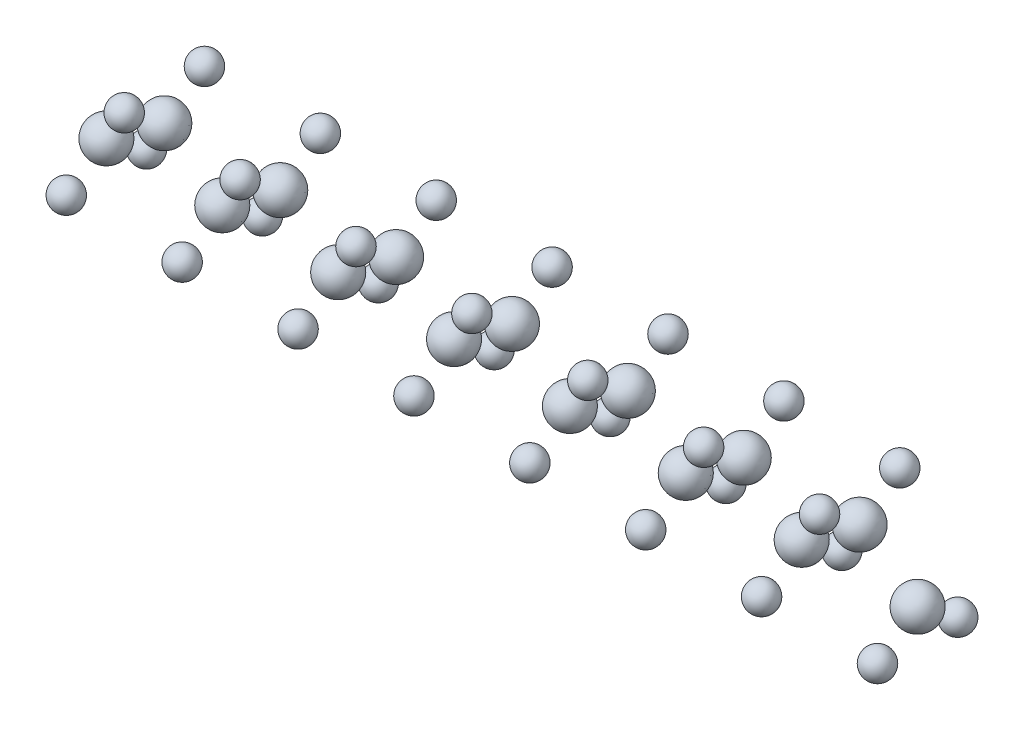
SolidWorks part; units mm, degrees
ref_plane "Front Plane" through (0, 0, 0) normal (0, 0, 1) x (1, 0, 0)
ref_plane "Top Plane" through (0, 0, 0) normal (0, 1, 0) x (1, 0, 0)
ref_plane "Right Plane" through (0, 0, 0) normal (1, 0, 0) x (0, 0, -1)
sketch "Sketch2" plane through (0, 0, 0) normal (0, 0, 1) x (1, 0, 0)
  line L0 (0, 0.425) -> (0, -0.425)
  arc A0 (0, 0.425) -> (0, -0.425) centre (0, 0) cw
  dimension "D2" = 0.85
  dimension "D1" = 0.425
revolve "Revolve2" add sketch "Sketch2" angle 360 about L0
sketch "Sketch3" plane through (0, 0, 0) normal (0, 0, 1) x (1, 0, 0)
  line L0 (0, 0) -> (1.2621, 0.9169) construction
  line L1 (1.2621, 0.9169) -> (2.5241, 0) construction
  line L2 (0.4675, 0) -> (-0.4675, 0) construction
  line L3 (2.5241, 0) -> (3.7862, 0.9169) construction
  line L4 (3.7862, 0.9169) -> (5.0483, 0) construction
  line L5 (5.0483, 0) -> (6.3103, 0.9169) construction
  line L6 (6.3103, 0.9169) -> (7.5724, 0) construction
  line L7 (7.5724, 0) -> (8.8345, 0.9169) construction
  line L8 (8.8345, 0.9169) -> (10.0965, 0) construction
  line L9 (10.0965, 0) -> (11.3586, 0.9169) construction
  line L10 (11.3586, 0.9169) -> (12.6207, 0) construction
  line L11 (12.6207, 0) -> (13.8827, 0.9169) construction
  line L12 (13.8827, 0.9169) -> (15.1448, 0) construction
  line L13 (15.1448, 0) -> (16.4069, 0.9169) construction
  line L14 (16.4069, 0.9169) -> (17.6689, 0) construction
  dimension "D1" = 36
  dimension "D2" = 36
  dimension "D3" = 1.56
  dimension "D4" = 1.56
pattern_linear "LPattern1" count 2 spacing 1.56 along (0.809, 0.5878, 0)
sketch "Sketch4" plane through (0, 0, 0) normal (0, 0, 1) x (1, 0, 0)
  line L0 (0, 0) -> (2.5241, 0) construction
pattern_linear "LPattern2" count 7 spacing 2.524 along (1, 0, 0)
sketch "Sketch5" plane through (0, 0, 0) normal (1, 0, 0) x (0, 0, -1)
  line L0 (0, 0) -> (-0.8737, -0.6348) construction
  line L1 (0, 0) -> (0.8737, -0.6348) construction
  line L2 (0.9611, 0) -> (-0.9611, 0) construction
  line L3 (-0.8737, -0.3223) -> (-0.8737, -0.9473)
  line L4 (-0.8737, -0.6348) -> (0.8737, -0.6348) construction
  arc A0 (-0.8737, -0.3223) -> (-0.8737, -0.9473) centre (-0.8737, -0.6348) cw
  dimension "D1" = 36
  dimension "D2" = 36
  dimension "D3" = 1.08
  dimension "D4" = 1.08
  dimension "D5" = 0.625
revolve "Revolve3" add sketch "Sketch5" angle 360 about L3
move or copy body "Body-Move/Copy1" bodies to move or copy 115
ref_plane "Plane1" through (1.2621, 0, 0) normal (1, 0, 0) x (0, 0, -1)
sketch "Sketch6" plane through (1.2621, 0, 0) normal (1, 0, 0) x (0, 0, -1)
  line L0 (0, 0.9169) -> (-0.8737, 1.5518) construction
  line L2 (0.8737, 1.5518) -> (0, 0.9169) construction
  line L3 (1.3049, 0) -> (-1.3049, 0) construction
  dimension "D1" = 36
  dimension "D2" = 36
  dimension "D3" = 1.08
move or copy body "Body-Move/Copy2" bodies to move or copy 115
move or copy body "Body-Move/Copy3" bodies to move or copy 117
move or copy body "Body-Move/Copy4" bodies to move or copy 108
move or copy body "Body-Move/Copy5" bodies to move or copy 115 116
move or copy body "Body-Move/Copy6" bodies to move or copy 117 118
sketch "Sketch7" plane through (0, 0, 0) normal (1, 0, 0) x (0, 0, -1)
  line L0 (0, 0) -> (-0.8737, -0.6348) construction
  line L1 (0, 0) -> (0.8737, -0.6348) construction
  line L3 (1.3049, 0) -> (-1.3049, 0) construction
  dimension "D1" = 36
  dimension "D2" = 36
  dimension "D3" = 1.08
  dimension "D4" = 1.08
